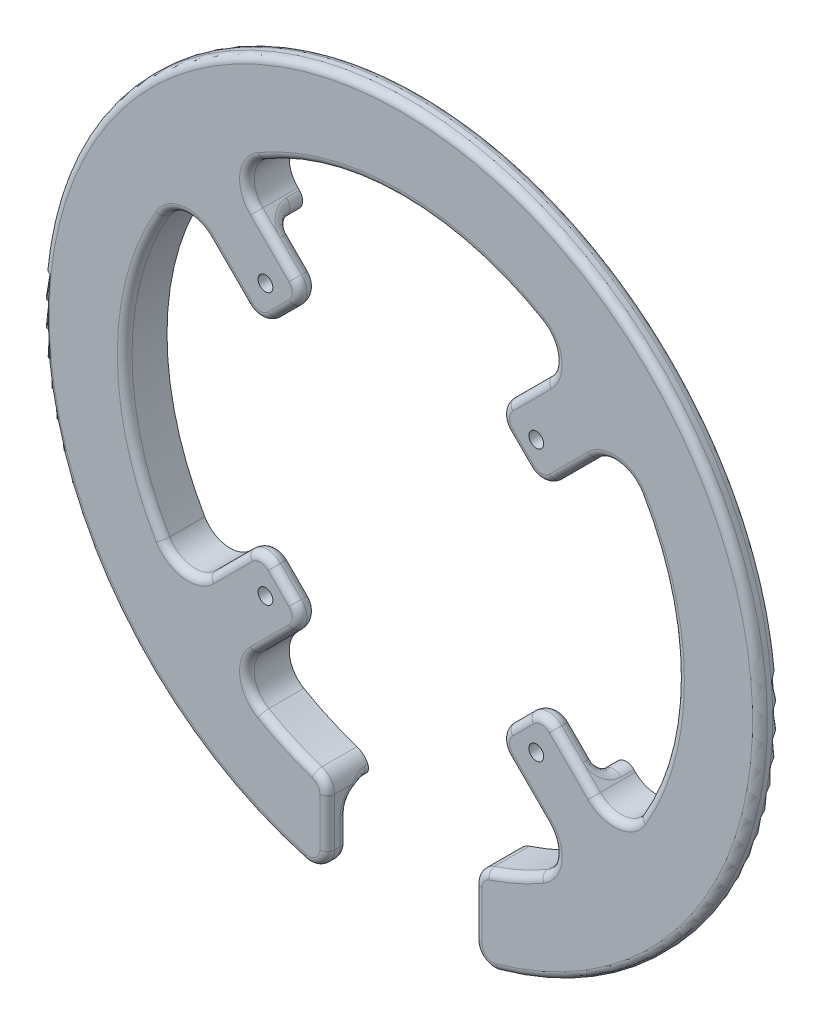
SolidWorks part; units mm, degrees
ref_plane "Спереди" through (0, 0, 0) normal (0, 0, 1) x (1, 0, 0)
ref_plane "Сверху" through (0, 0, 0) normal (0, 1, 0) x (1, 0, 0)
ref_plane "Справа" through (0, 0, 0) normal (1, 0, 0) x (0, 0, -1)
sketch "Эскиз1" plane through (0, 0, 0) normal (0, 0, 1) x (1, 0, 0)
  circle A0 centre (0, 0) radius 97.5
  circle A1 centre (0, 0) radius 75
  dimension "D1" = 195
  dimension "D2" = 150
extrude "Бобышка-Вытянуть1" add sketch "Эскиз1" along normal blind 11.5
sketch "Эскиз2" plane through (0, 0, 0) normal (0, 0, -1) x (-1, 0, 0)
  circle A0 centre (0, 0) radius 80
  circle A1 centre (0, 0) radius 97.5
  circle A2 centre (0, 0) radius 97.5
  dimension "D2" = 160
  dimension "D1" = 0
extrude "Вырез-Вытянуть2" cut sketch "Эскиз2" against normal blind 6
fillet "Скругление1" radius 5 1 edges at (-80, 0, 6)
sketch "Эскиз3" plane through (0, 0, 11.5) normal (0, 0, 1) x (1, 0, 0)
  line L0 (-36.7696, 36.7696) -> (36.7696, -36.7696) construction
  line L1 (-36.7696, 36.7696) -> (36.7696, 36.7696) construction
  line L2 (-36.7696, 36.7696) -> (-36.7696, -36.7696) construction
  line L3 (-36.7696, -36.7696) -> (36.7696, -36.7696) construction
  line L4 (36.7696, 36.7696) -> (36.7696, -36.7696) construction
  line L7 (-25.4558, 38.1838) -> (-38.1838, 25.4558)
  line L8 (-38.1838, 25.4558) -> (-59.0137, 46.2858)
  line L9 (-25.4558, 38.1838) -> (-46.2858, 59.0137)
  circle A5 centre (0, 0) radius 75 construction
  circle A9 centre (-36.7696, 36.7696) radius 2
  arc A11 (-46.2858, 59.0137) -> (-59.0137, 46.2858) centre (0, 0) ccw
  point P27 (0, 0)
  dimension "D3" = 45
  dimension "D5" = 4
  dimension "D1" = 104
  dimension "D2" = 73.5391
  dimension "D4" = 18
extrude "Бобышка-Вытянуть2" add sketch "Эскиз3" against normal up to surface (11.5 mm away)
fillet "Скругление2" radius 8 2 edges at (-46.2858, 59.0137, 5.75) (-59.0137, 46.2858, 5.75)
fillet "Скругление3" radius 5 2 edges at (-38.1838, 25.4558, 5.75) (-25.4558, 38.1838, 5.75)
pattern_circular "Круговой массив1" count 4 over 360 about axis through (0, 0, 0) along (0, 0, 1) of "Бобышка-Вытянуть2", "Скругление2", "Скругление3"
sketch "Эскиз4" plane through (0, 0, 0) normal (0, 0, -1) x (-1, 0, 0)
  circle A0 centre (0, 0) radius 61.5
  dimension "D1" = 123
extrude "Вырез-Вытянуть3" cut sketch "Эскиз4" against normal blind 6.5
fillet "Скругление4" radius 3 4 edges at (43.4871, 43.4871, 6.5) (43.4871, -43.4871, 6.5) (-43.4871, -43.4871, 6.5) (-43.4871, 43.4871, 6.5)
sketch "Эскиз6" plane through (0, 0, 11.5) normal (0, 0, 1) x (1, 0, 0)
  line L0 (0, -72.2842) -> (0, 0) construction
  line L1 (-20, -72.2842) -> (20, -72.2842)
  line L2 (-20, -72.2842) -> (-20, -97.5)
  line L3 (-20, -97.5) -> (20, -97.5)
  line L4 (20, -72.2842) -> (20, -97.5)
  arc A0 (-37.8414, -64.7536) -> (37.8414, -64.7536) centre (0, 0) ccw construction
  circle A1 centre (0, 0) radius 97.5 construction
  dimension "D1" = 40
extrude "Вырез-Вытянуть4" cut sketch "Эскиз6" against normal through all
fillet "Скругление6" radius 5 4 edges at (20, -72.2842, 5.75) (20, -95.4267, 8.75) (-20, -72.2842, 5.75) (-20, -95.4267, 8.75)
fillet "Скругление7" radius 2 51 edges at (-30.8108, -68.3791, 11.5) (-34.2266, -46.9545, 11.5) (-58.8699, -41.7392, 11.5) (-41.7392, -58.8699, 11.5) (75, 0, 11.5) (46.9545, -34.2266, 11.5) (41.7392, -58.8699, 11.5) (58.8699, -41.7392, 11.5) (0, 75, 11.5) (34.2266, 46.9545, 11.5) (58.8699, 41.7392, 11.5) (41.7392, 58.8699, 11.5) (-31.8198, -31.8198, 11.5) (-46.9545, -34.2266, 11.5) (-38.1838, -27.5269, 11.5) (-27.5269, -38.1838, 11.5) (31.8198, -31.8198, 11.5) (34.2266, -46.9545, 11.5) (27.5269, -38.1838, 11.5) (38.1838, -27.5269, 11.5) (31.8198, 31.8198, 11.5) (46.9545, 34.2266, 11.5) (38.1838, 27.5269, 11.5) (27.5269, 38.1838, 11.5) (20, -79.1103, 4.6653) (-20, -78.4599, 3.958) (20, -76.7265, 0) (-20, -77.4597, 0.5) (20, -77.4597, 0.5) (20, -85.8356, 6) (30.8108, -68.3791, 11.5) (-20, -82.5255, 11.5) (20, -82.5255, 11.5) (0, 97.5, 11.5) (-21.9798, -93.0423, 11.5) (-20.9495, -73.0619, 11.5) (21.9798, -93.0423, 11.5) (20.9495, -73.0619, 11.5) (-20, -76.7265, 0) (0, 97.5, 6) (-20, -85.8356, 6) (-21.9798, -93.0423, 6) (21.9798, -93.0423, 6) (-75, 0, 11.5) (-46.9545, 34.2266, 11.5) (-41.7392, 58.8699, 11.5) (-58.8699, 41.7392, 11.5) (-31.8198, 31.8198, 11.5) (-34.2266, 46.9545, 11.5) (-27.5269, 38.1838, 11.5) (-38.1838, 27.5269, 11.5)
fillet "Скругление5" radius 3 36 edges at (36.6549, -49.3829, 1.75) (35.8617, -48.5896, 5.8294) (48.9216, -36.1937, 5.3587) (36.6549, 49.3829, 1.75) (36.1937, 48.9216, 5.3587) (48.5896, 35.8617, 5.8294) (-36.6549, 49.3829, 1.75) (-35.8617, 48.5896, 5.8294) (-48.9216, 36.1937, 5.3587) (-49.3829, -36.6549, 1.75) (-48.5896, -35.8617, 5.8294) (-36.1937, -48.9216, 5.3587) (49.3829, -36.6549, 1.75) (49.3829, 36.6549, 1.75) (-49.3829, 36.6549, 1.75) (-36.6549, -49.3829, 1.75) (31.7503, -44.4783, 6.5) (27.5269, -38.1838, 6.5) (31.8198, -31.8198, 6.5) (38.1838, -27.5269, 6.5) (44.4783, -31.7503, 6.5) (31.7503, 44.4783, 6.5) (27.5269, 38.1838, 6.5) (31.8198, 31.8198, 6.5) (38.1838, 27.5269, 6.5) (44.4783, 31.7503, 6.5) (-31.7503, 44.4783, 6.5) (-27.5269, 38.1838, 6.5) (-31.8198, 31.8198, 6.5) (-38.1838, 27.5269, 6.5) (-44.4783, 31.7503, 6.5) (-44.4783, -31.7503, 6.5) (-38.1838, -27.5269, 6.5) (-31.8198, -31.8198, 6.5) (-27.5269, -38.1838, 6.5) (-31.7503, -44.4783, 6.5)
